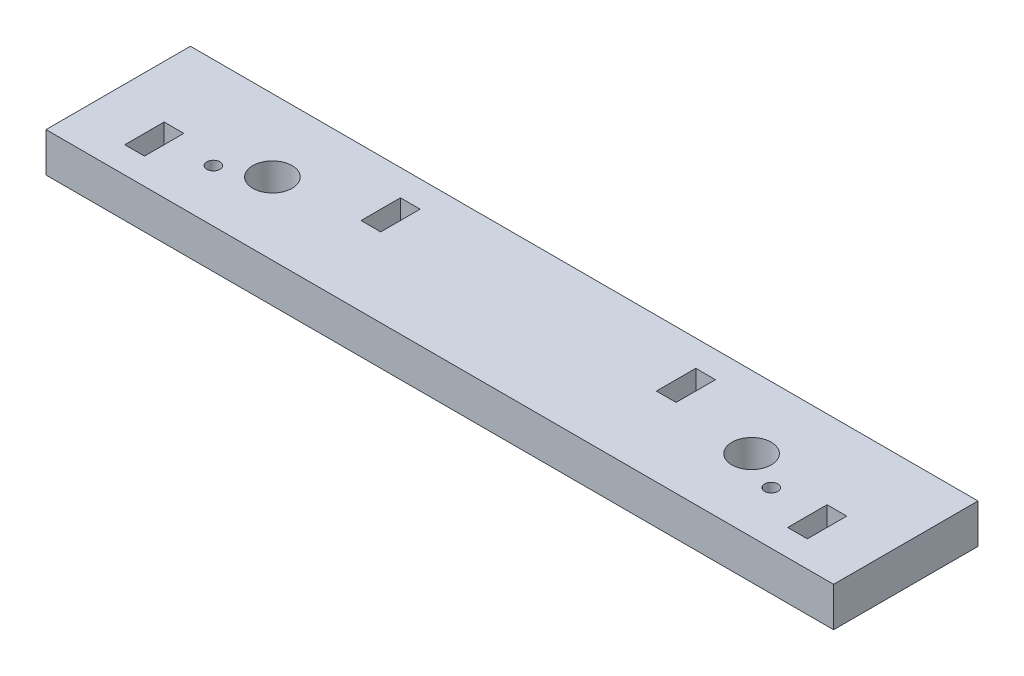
SolidWorks part; units mm, degrees
ref_plane "Front Plane" through (0, 0, 0) normal (0, 0, 1) x (1, 0, 0)
ref_plane "Top Plane" through (0, 0, 0) normal (0, 1, 0) x (1, 0, 0)
ref_plane "Right Plane" through (0, 0, 0) normal (1, 0, 0) x (0, 0, -1)
sketch "Sketch1" plane through (0, 0, 0) normal (0, 1, 0) x (1, 0, 0)
  line L0 (0, 0) -> (0, 12.7)
  line L1 (0, 0) -> (381, 0)
  line L2 (0, 0) -> (0, 69.85)
  line L3 (0, 69.85) -> (381, 69.85)
  line L4 (381, 0) -> (381, 69.85)
  line L5 (0, 12.7) -> (25.4, 12.7)
  line L6 (0, 69.85) -> (0, 57.15)
  line L7 (25.4, 12.7) -> (34.925, 12.7)
  line L8 (25.4, 12.7) -> (25.4, 31.75)
  line L9 (25.4, 22.225) -> (34.925, 22.225)
  line L10 (34.925, 12.7) -> (34.925, 31.75)
  line L11 (0, 57.15) -> (114.3, 57.15)
  line L12 (34.925, 34.925) -> (114.3, 34.925)
  line L13 (114.3, 57.15) -> (123.825, 57.15)
  line L14 (114.3, 57.15) -> (114.3, 38.1)
  line L15 (114.3, 47.625) -> (123.825, 47.625)
  line L16 (123.825, 57.15) -> (123.825, 38.1)
  line L17 (74.6125, 25.4) -> (55.5625, 25.4)
  line L18 (190.5, 69.85) -> (190.5, 0)
  line L19 (306.3875, 25.4) -> (325.4375, 25.4)
  line L20 (257.175, 57.15) -> (257.175, 38.1)
  line L21 (266.7, 47.625) -> (257.175, 47.625)
  line L22 (266.7, 57.15) -> (266.7, 38.1)
  line L23 (266.7, 57.15) -> (257.175, 57.15)
  line L24 (346.075, 34.925) -> (266.7, 34.925)
  line L25 (346.075, 12.7) -> (346.075, 31.75)
  line L26 (355.6, 22.225) -> (346.075, 22.225)
  line L27 (355.6, 12.7) -> (355.6, 31.75)
  line L28 (355.6, 12.7) -> (346.075, 12.7)
  line L29 (25.4, 31.75) -> (34.925, 31.75)
  line L30 (114.3, 38.1) -> (123.825, 38.1)
  line L31 (266.7, 38.1) -> (257.175, 38.1)
  line L32 (355.6, 31.75) -> (346.075, 31.75)
  circle A0 centre (74.6125, 34.925) radius 9.525
  circle A1 centre (55.5625, 25.4) radius 3.175
  circle A2 centre (325.4375, 25.4) radius 3.175
  circle A3 centre (306.3875, 34.925) radius 9.525
  dimension "D11" = 19.05
  dimension "D12" = 74.6125
  dimension "D13" = 22.225
  dimension "D14" = 6.35
  dimension "D15" = 55.5625
  dimension "D1" = 381
  dimension "D2" = 69.85
  dimension "D3" = 9.525
  dimension "D4" = 9.525
  dimension "D5" = 25.4
  dimension "D6" = 12.7
  dimension "D7" = 9.525
  dimension "D8" = 9.525
  dimension "D9" = 114.3
  dimension "D10" = 12.7
extrude "Boss-Extrude1" add sketch "Sketch1" along normal blind 19.05
